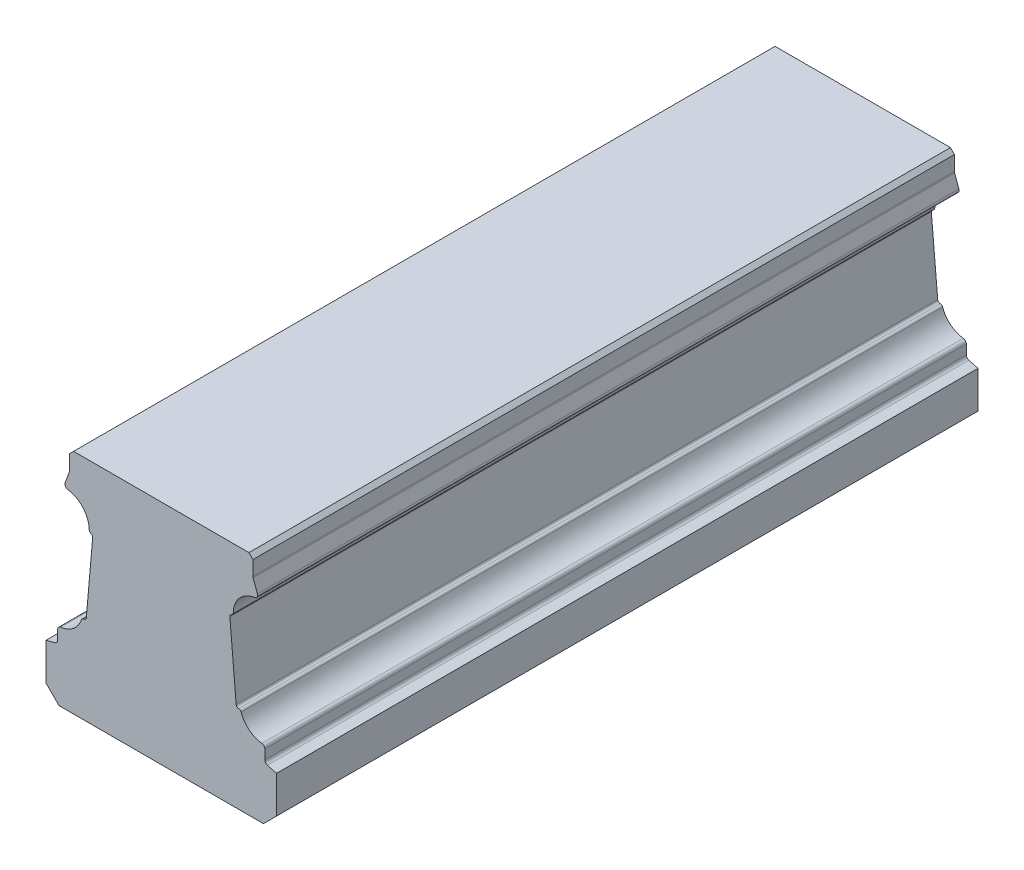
SolidWorks part; units mm, degrees
ref_plane "Vorne" through (0, 0, 0) normal (0, 0, 1) x (1, 0, 0)
ref_plane "Oben" through (0, 0, 0) normal (0, 1, 0) x (1, 0, 0)
ref_plane "Rechts" through (0, 0, 0) normal (1, 0, 0) x (0, 0, -1)
sketch "Skizze1" plane through (0, 0, 0) normal (0, 0, 1) x (1, 0, 0)
  line L0 (-11.5, 5) -> (-11.5, 0) construction
  line L1 (-11.5, 0) -> (11.5, 0) construction
  line L2 (11.5, 0) -> (11.5, 5) construction
  line L3 (7.479, 8.9385) -> (6.844, 16.1966)
  line L4 (9.5927, 19.5605) -> (9.1707, 20.7199)
  line L5 (9.15, 20.8372) -> (9.15, 22.3)
  line L6 (9.15, 22.7) -> (-9.15, 22.7) construction
  line L7 (-9.15, 22.3) -> (-9.15, 20.8372)
  line L8 (-9.1707, 20.7199) -> (-9.5927, 19.5605)
  line L9 (-6.844, 16.1966) -> (-7.479, 8.9385)
  line L10 (0, 22.7) -> (0, 0) construction
  line L11 (-9.15, 20.7768) -> (-8.45, 22.7) construction
  line L12 (-6.844, 16.1966) -> (-6.275, 22.7) construction
  line L13 (9.15, 20.7768) -> (8.45, 22.7) construction
  line L14 (6.844, 16.1966) -> (6.275, 22.7) construction
  line L15 (-11.5, 5) -> (-10.5892, 5.244)
  line L16 (-10.335, 5.5754) -> (-10.335, 6.5191)
  line L17 (10.335, 6.5191) -> (10.335, 5.5754)
  line L18 (10.5892, 5.244) -> (11.5, 5)
  line L19 (-6.25, 22.7) -> (-6.25, 20.7) construction
  line L20 (-6.25, 20.7) -> (6.25, 20.7) construction
  line L21 (6.25, 20.7) -> (6.25, 22.7) construction
  line L22 (-8.75, 22.7) -> (-6.25, 22.7)
  line L23 (8.75, 22.7) -> (6.25, 22.7) construction
  line L24 (-9.15, 22.3) -> (-8.75, 22.7)
  line L25 (9.15, 22.3) -> (8.75, 22.7)
  line L26 (-11.5, 5) -> (-11.5, 1.3)
  line L27 (-11.5, 1.3) -> (-10.2, 0)
  line L28 (-10.2, 0) -> (10.2, 0)
  line L29 (10.2, 0) -> (11.5, 1.3)
  line L30 (11.5, 1.3) -> (11.5, 5)
  line L31 (8.75, 22.7) -> (-6.25, 22.7)
  arc A0 (-7.9711, 8.5284) -> (-10.0308, 6.8599) centre (-10.31, 9.31) cw
  arc A1 (10.0308, 6.8599) -> (7.9711, 8.5284) centre (10.31, 9.31) cw
  arc A2 (7.9711, 8.5284) -> (7.7312, 8.7039) centre (7.7274, 8.4469) ccw
  arc A3 (7.7312, 8.7039) -> (7.479, 8.9385) centre (7.735, 8.9609) cw
  arc A4 (6.844, 16.1966) -> (7.0137, 16.461) centre (7.1, 16.219) cw
  arc A5 (7.0137, 16.461) -> (7.1843, 16.699) centre (6.9273, 16.7031) ccw
  arc A6 (7.1843, 16.699) -> (9.3167, 19.1034) centre (9.65, 16.66) cw
  arc A7 (-9.3167, 19.1034) -> (-7.1843, 16.699) centre (-9.65, 16.66) cw
  arc A8 (-7.1843, 16.699) -> (-7.0137, 16.461) centre (-6.9273, 16.7031) ccw
  arc A9 (-7.0137, 16.461) -> (-6.844, 16.1966) centre (-7.1, 16.219) cw
  arc A10 (-7.479, 8.9385) -> (-7.7312, 8.7039) centre (-7.735, 8.9609) cw
  arc A11 (-7.7312, 8.7039) -> (-7.9711, 8.5284) centre (-7.7274, 8.4469) ccw
  arc A12 (-10.5892, 5.244) -> (-10.335, 5.5754) centre (-10.678, 5.5754) ccw
  arc A13 (10.335, 5.5754) -> (10.5892, 5.244) centre (10.678, 5.5754) ccw
  arc A14 (10.335, 6.5191) -> (10.0308, 6.8599) centre (9.992, 6.5191) ccw
  arc A15 (-10.0308, 6.8599) -> (-10.335, 6.5191) centre (-9.992, 6.5191) ccw
  arc A16 (9.1707, 20.7199) -> (9.15, 20.8372) centre (9.493, 20.8372) cw
  arc A17 (-9.15, 20.8372) -> (-9.1707, 20.7199) centre (-9.493, 20.8372) cw
  arc A18 (9.5927, 19.5605) -> (9.3167, 19.1034) centre (9.2704, 19.4432) cw
  arc A19 (-9.5927, 19.5605) -> (-9.3167, 19.1034) centre (-9.2704, 19.4432) ccw
  point P2 (0, 20.7)
  point P54 (0, 0)
  point P61 (-10.335, 5.3122)
  point P64 (10.335, 5.3122)
  dimension "D10" = 2.466
  dimension "D11" = 0.257
  dimension "D17" = 75
  dimension "D22" = 0.343
  dimension "D15" = 15.47
  dimension "D1" = 23
  dimension "D2" = 22.7
  dimension "D3" = 10
  dimension "D4" = 40
  dimension "D5" = 18.3
  dimension "D6" = 16.9
  dimension "D7" = 12.55
  dimension "D8" = 20.62
  dimension "D9" = 9.31
  dimension "D12" = 6.04
  dimension "D13" = 19.3
  dimension "D14" = 14.2
  dimension "D16" = 5
  dimension "D18" = 1.165
  dimension "D19" = 12.5
  dimension "D20" = 2
  dimension "D21" = 3.7
extrude "Aufsatz-Linear austragen1" add sketch "Skizze1" along normal blind 70
hole_wizard "Stirnsenkung für M6 Zylinderschraube mit Innensechskant1" positions "Skizze2" profile "Skizze3" counterbore size "M6" standard "DIN"
sketch "Skizze2" plane through (0, 22.7, 0) normal (0, 1, 0) x (1, 0, 0)
  point P0 (0, -30)
  point P10 (0, -90)
  point P11 (0, -150)
  dimension "D1" = 30
  dimension "D3" = 60
  dimension "D2" = 3
sketch "Skizze3" plane through (0, 22.7, 30) normal (1, 0, 0) x (0, 0, 1)
  line L0 (0, 0) -> (0, 22.7)
  line L1 (0, 22.7) -> (3.5, 22.7)
  line L3 (3.5, 22.7) -> (3.5, 8.7)
  line L4 (3.5, 8.7) -> (5.5, 8.7)
  line L5 (5.5, 8.7) -> (5.5, 0)
  line L7 (5.5, 0) -> (0, 0)
  line L11 (0, -6.35) -> (0, 107.95) construction
  dimension "Bohrerdurchmesser" = 7
  dimension "Bohrungstiefe" = 22.7
  dimension "Senkdurchmesser2" = 11
  dimension "Senktiefe2" = 8.7
